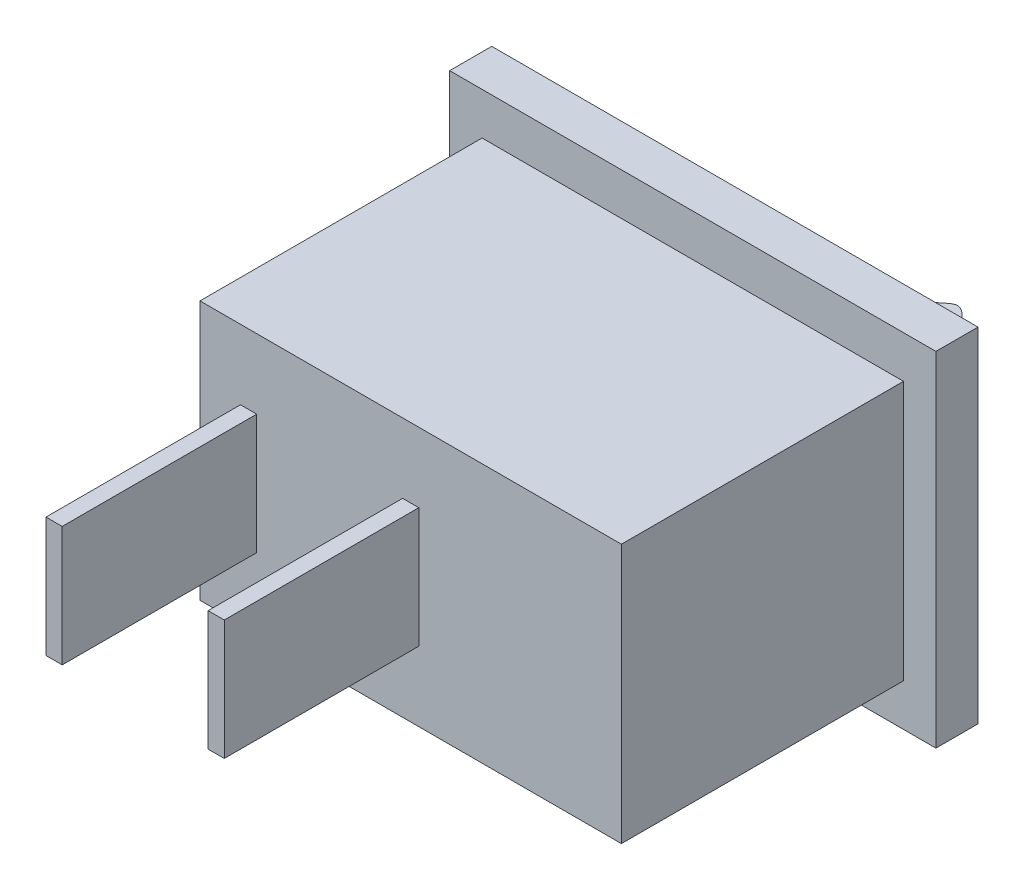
SolidWorks part; units mm, degrees
ref_plane "Front Plane" through (0, 0, 0) normal (0, 0, 1) x (1, 0, 0)
ref_plane "Top Plane" through (0, 0, 0) normal (0, 1, 0) x (1, 0, 0)
ref_plane "Right Plane" through (0, 0, 0) normal (1, 0, 0) x (0, 0, -1)
sketch "草图1" plane through (0, 0, 0) normal (0, 1, 0) x (1, 0, 0)
  line L0 (0, 0) -> (0, -14.7139) construction
  line L1 (-7.5, 8) -> (7.5, 8)
  line L2 (-7.5, 8) -> (-7.5, -2)
  line L3 (-5.25, -8) -> (-4.75, -8)
  line L4 (7.5, 8) -> (7.5, -2)
  line L5 (-7.5, 8) -> (7.5, -8) construction
  line L6 (-7.5, -8) -> (7.5, 8) construction
  line L7 (-5, -8) -> (-5, 0) construction
  line L9 (0.25, -8) -> (0.25, -2)
  line L11 (-0.25, -8) -> (-0.25, -2)
  line L12 (0, -8) -> (-0.25, -2) construction
  line L13 (0.25, -2) -> (0, -8) construction
  line L14 (-7.5, -2) -> (-5.25, -2)
  line L16 (-5.25, -8) -> (-5.25, -2)
  line L18 (-4.75, -8) -> (-4.75, -2)
  line L19 (-5, -8) -> (-4.75, -2) construction
  line L20 (-5.25, -2) -> (-5, -8) construction
  line L21 (-4.75, -2) -> (-0.25, -2)
  line L22 (0.25, -2) -> (7.5, -2)
  line L23 (-0.25, -8) -> (0.25, -8)
  point P0 (0, 0)
  point P8 (0, -8)
  dimension "D1" = 16
  dimension "D2" = 15
  dimension "D3" = 0.5
  dimension "D4" = 6
  dimension "D5" = 5
extrude "凸台-拉伸1" add sketch "草图1" along normal mid plane 10.6
sketch "草图2" plane through (-7.5, 0, 0) normal (-1, 0, 0) x (0, 0, 1)
  line L0 (0, 0) -> (12.5315, 0) construction
  line L1 (2, 5.3) -> (2, -5.3) construction
  line L2 (2, 1.85) -> (8, 1.85)
  line L4 (2, -1.85) -> (8, -1.85)
  line L6 (-4, 1.85) -> (8, -1.85) construction
  line L7 (-4, -1.85) -> (8, 1.85) construction
  line L8 (8, 5.3) -> (8, -5.3) construction
  line L9 (2, 1.85) -> (2, 5.9749)
  line L10 (2, 5.9749) -> (11.6659, 5.9749)
  line L11 (11.6659, 5.9749) -> (11.6659, 1.85)
  line L12 (11.6659, 1.85) -> (8, 1.85)
  line L13 (2, -1.85) -> (2, -6.0805)
  line L14 (2, -6.0805) -> (11.6659, -6.0805)
  line L15 (11.6659, -6.0805) -> (11.6659, -1.85)
  line L16 (11.6659, -1.85) -> (8, -1.85)
  point P3 (2, 0)
  dimension "D1" = 3.7
extrude "切除-拉伸1" cut sketch "草图2" against normal blind 10.6
sketch "草图3" plane through (-7.5, 0, 0) normal (-1, 0, 0) x (0, 0, 1)
  line L1 (-6.7019, 4) -> (6.7019, 4) construction
  line L2 (-6.7019, 4) -> (-6.7019, -4) construction
  line L3 (-6.7019, -4) -> (6.7019, -4) construction
  line L4 (6.7019, 4) -> (6.7019, -4) construction
  line L5 (-6.7019, 4) -> (6.7019, -4) construction
  line L6 (-6.7019, -4) -> (6.7019, 4) construction
  line L7 (-6.7019, 4) -> (6.7019, 4)
  line L8 (-6.7019, 4) -> (-6.7019, 6.0172)
  line L9 (-6.7019, 6.0172) -> (6.7019, 6.0172)
  line L10 (6.7019, 4) -> (6.7019, 6.0172)
  line L11 (-6.7019, -4) -> (6.7019, -4)
  line L12 (-6.7019, -4) -> (-6.7019, -7.3597)
  line L13 (-6.7019, -7.3597) -> (6.7019, -7.3597)
  line L14 (6.7019, -4) -> (6.7019, -7.3597)
  point P0 (0, 0)
  dimension "D1" = 8
extrude "切除-拉伸2" cut sketch "草图3" against normal blind 20.6
sketch "草图4" plane through (0, -4, 0) normal (0, -1, 0) x (1, 0, 0)
  line L0 (7.5, -6.7019) -> (-7.5, -6.7019) construction
  line L1 (-6.5, 6.7019) -> (6.5, 6.7019) construction
  line L2 (-6.5, 6.7019) -> (-6.5, -6.7019) construction
  line L3 (-6.5, -6.7019) -> (6.5, -6.7019) construction
  line L4 (6.5, 6.7019) -> (6.5, -6.7019) construction
  line L5 (-6.5, 6.7019) -> (6.5, -6.7019) construction
  line L6 (-6.5, -6.7019) -> (6.5, 6.7019) construction
  line L8 (-6.5, -6.7019) -> (-12.0745, -6.7019)
  line L9 (-6.5, -6.7019) -> (-6.5, 6.7019)
  line L10 (-6.5, 6.7019) -> (-12.0745, 6.7019)
  line L11 (-12.0745, -6.7019) -> (-12.0745, 6.7019)
  line L12 (6.5, -6.7019) -> (11.937, -6.7019)
  line L13 (6.5, -6.7019) -> (6.5, 6.7019)
  line L14 (6.5, 6.7019) -> (11.937, 6.7019)
  line L15 (11.937, -6.7019) -> (11.937, 6.7019)
  point P0 (0, 0)
  dimension "D1" = 13
extrude "切除-拉伸3" cut sketch "草图4" against normal blind 20.6
sketch "草图5" plane through (0, 0, 0) normal (0, 1, 0) x (1, 0, 0)
  line L0 (0, 0) -> (0, 10.9737) construction
  line L1 (-4.4307, 8) -> (5.0202, 8)
  line L2 (7.5, 8) -> (-7.5, 8) construction
  arc A0 (-4.4307, 8) -> (3.5168, 10.9015) centre (-4.4307, 20.3352) ccw
  spline S0 degree 3 poles (3.5168, 10.9015) (3.6608, 11.0228) (3.9218, 11.1636) (4.993, 9.8907) (4.9362, 8.9305) (5.0202, 8) knots 0 0 0 0 0.090529 0.311978 1 1 1 1
  point P8 (0.2947, 8)
  dimension "D1" = 24.6704
extrude "凸台-拉伸2" add sketch "草图5" along normal mid plane 5
